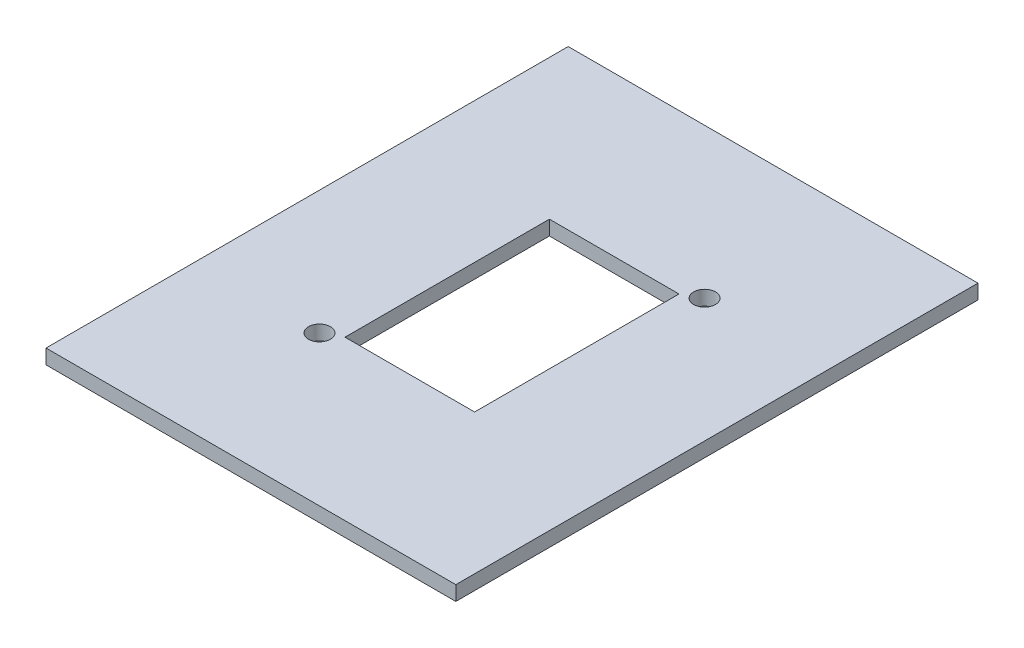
SolidWorks part; units mm, degrees
ref_plane "Front Plane" through (0, 0, 0) normal (0, 0, 1) x (1, 0, 0)
ref_plane "Top Plane" through (0, 0, 0) normal (0, 1, 0) x (1, 0, 0)
ref_plane "Right Plane" through (0, 0, 0) normal (1, 0, 0) x (0, 0, -1)
sketch "Sketch1" plane through (0, 0, 0) normal (0, 1, 0) x (1, 0, 0)
  line L0 (0, 0) -> (0, 35.7649) construction
  line L1 (-8.875, 14) -> (8.875, 14)
  line L2 (-8.875, 14) -> (-8.875, -14)
  line L3 (-8.875, -14) -> (8.875, -14)
  line L4 (8.875, 14) -> (8.875, -14)
  line L5 (-8.875, 14) -> (8.875, -14) construction
  line L6 (-8.875, -14) -> (8.875, 14) construction
  line L7 (-28.0676, 35.7649) -> (28.0676, 35.7649)
  line L8 (-28.0676, 35.7649) -> (-28.0676, -35.7649)
  line L9 (-28.0676, -35.7649) -> (28.0676, -35.7649)
  line L10 (28.0676, 35.7649) -> (28.0676, -35.7649)
  line L11 (-28.0676, 35.7649) -> (28.0676, -35.7649) construction
  line L12 (-28.0676, -35.7649) -> (28.0676, 35.7649) construction
  line L13 (0, 0) -> (28.0676, 0) construction
  line L14 (11.125, 0) -> (11.125, 35.7649) construction
  line L15 (-11.125, 0) -> (-11.125, 35.7649) construction
  line L16 (0, -15.25) -> (28.0676, -15.25) construction
  line L17 (0, 15.25) -> (28.0676, 15.25) construction
  circle A0 centre (11.125, 15.25) radius 1.5
  circle A2 centre (-11.125, -15.25) radius 1.5
  point P0 (0, 0)
  point P6 (0, 0)
  dimension "D1" = 17.75
  dimension "D2" = 28
  dimension "D3" = 11.125
  dimension "D4" = 11.125
  dimension "D5" = 15.25
  dimension "D6" = 15.25
extrude "Boss-Extrude1" add sketch "Sketch1" along normal blind 2
